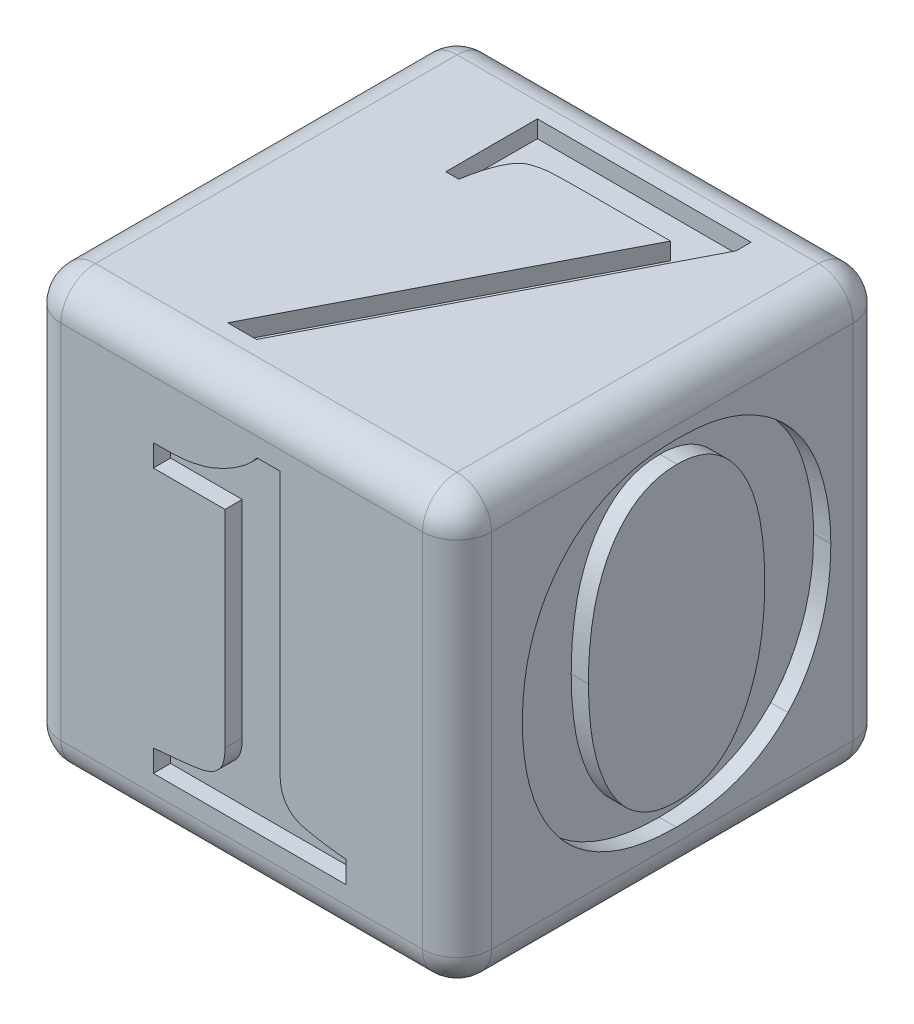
SolidWorks part; units mm, degrees
ref_plane "Front Plane" through (0, 0, 0) normal (0, 0, 1) x (1, 0, 0)
ref_plane "Top Plane" through (0, 0, 0) normal (0, 1, 0) x (1, 0, 0)
ref_plane "Right Plane" through (0, 0, 0) normal (1, 0, 0) x (0, 0, -1)
sketch "Sketch1" plane through (0, 0, 0) normal (0, 1, 0) x (1, 0, 0)
  line L1 (-12.5, 12.5) -> (12.5, 12.5)
  line L2 (-12.5, 12.5) -> (-12.5, -12.5)
  line L3 (-12.5, -12.5) -> (12.5, -12.5)
  line L4 (12.5, 12.5) -> (12.5, -12.5)
  line L5 (-12.5, 12.5) -> (12.5, -12.5) construction
  line L6 (-12.5, -12.5) -> (12.5, 12.5) construction
  point P0 (0, 0)
  dimension "D1" = 25
  dimension "D2" = 25
extrude "Boss-Extrude1" add sketch "Sketch1" along normal blind 25
fillet "Fillet1" radius 2 4 edges at (12.5, 12.5, 12.5) (12.5, 25, 0) (12.5, 12.5, -12.5) (12.5, 0, 0)
fillet "Fillet2" radius 2 5 edges at (11.9142, 24.4142, 11.9142) (11.9142, 0.5858, 11.9142) (-1, 25, 12.5) (-12.5, 12.5, 12.5) (-1, 0, 12.5)
fillet "Fillet3" radius 2 5 edges at (-11.9142, 24.4142, 11.9142) (-11.9142, 0.5858, 11.9142) (-12.5, 25, -1) (-12.5, 12.5, -12.5) (-12.5, 0, -1)
fillet "Fillet4" radius 2 6 edges at (11.9142, 24.4142, -11.9142) (-11.9142, 24.4142, -11.9142) (11.9142, 0.5858, -11.9142) (-11.9142, 0.5858, -11.9142) (0, 25, -12.5) (0, 0, -12.5)
sketch "Sketch9" plane through (0, 0, -12.5) normal (0, 0, -1) x (-1, 0, 0)
  text T0 "6" font "Georgia" height 19
extrude "Cut-Extrude7" cut sketch "Sketch9" against normal blind 1
sketch "Sketch10" plane through (-12.5, 0, 0) normal (-1, 0, 0) x (0, 0, 1)
  text T0 "2" font "Georgia" height 24
extrude "Cut-Extrude8" cut sketch "Sketch10" against normal blind 1
sketch "Sketch11" plane through (0, 0, 12.5) normal (0, 0, 1) x (1, 0, 0)
  text T0 "1" font "Georgia" height 24
extrude "Cut-Extrude9" cut sketch "Sketch11" against normal blind 1
sketch "Sketch12" plane through (12.5, 0, 0) normal (1, 0, 0) x (0, 0, -1)
  text T0 "0" font "Georgia" height 24
extrude "Cut-Extrude10" cut sketch "Sketch12" against normal blind 1
sketch "Sketch13" plane through (0, 25, 0) normal (0, 1, 0) x (1, 0, 0)
  text T0 "7" font "Georgia" height 19
extrude "Cut-Extrude11" cut sketch "Sketch13" against normal blind 1
sketch "Sketch14" plane through (0, 0, 0) normal (0, -1, 0) x (1, 0, 0)
  text T0 "8" font "Georgia" height 19
extrude "Cut-Extrude12" cut sketch "Sketch14" against normal blind 1
